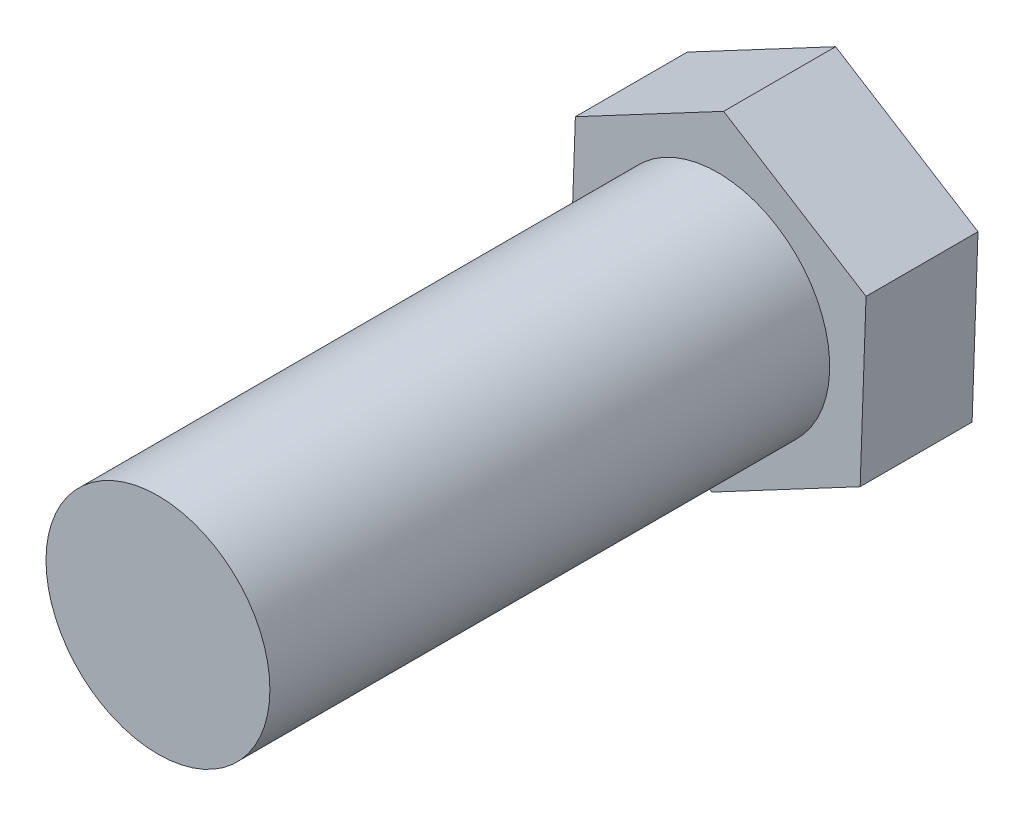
SolidWorks part; units mm, degrees
ref_plane "Alzado" through (0, 0, 0) normal (0, 0, 1) x (1, 0, 0)
ref_plane "Planta" through (0, 0, 0) normal (0, 1, 0) x (1, 0, 0)
ref_plane "Vista lateral" through (0, 0, 0) normal (1, 0, 0) x (0, 0, -1)
sketch "Croquis1" plane through (0, 0, 0) normal (0, 0, 1) x (1, 0, 0)
  circle A0 centre (0, 0) radius 5
  dimension "D1" = 10
extrude "Saliente-Extruir1" add sketch "Croquis1" along normal blind 30
sketch "Croquis2" plane through (0, 0, 0) normal (0, 0, -1) x (-1, 0, 0)
  line L1 (-0.2635, 7.4954) -> (-6.6229, 3.5195)
  line L2 (-6.6229, 3.5195) -> (-6.3594, -3.9759)
  line L3 (-6.3594, -3.9759) -> (0.2635, -7.4954)
  line L4 (0.2635, -7.4954) -> (6.6229, -3.5195)
  line L5 (6.6229, -3.5195) -> (6.3594, 3.9759)
  line L6 (6.3594, 3.9759) -> (-0.2635, 7.4954)
  circle A1 centre (0, 0) radius 6.4952 construction
  dimension "D1" = 7.4954
extrude "Saliente-Extruir2" add sketch "Croquis2" against normal blind 5
